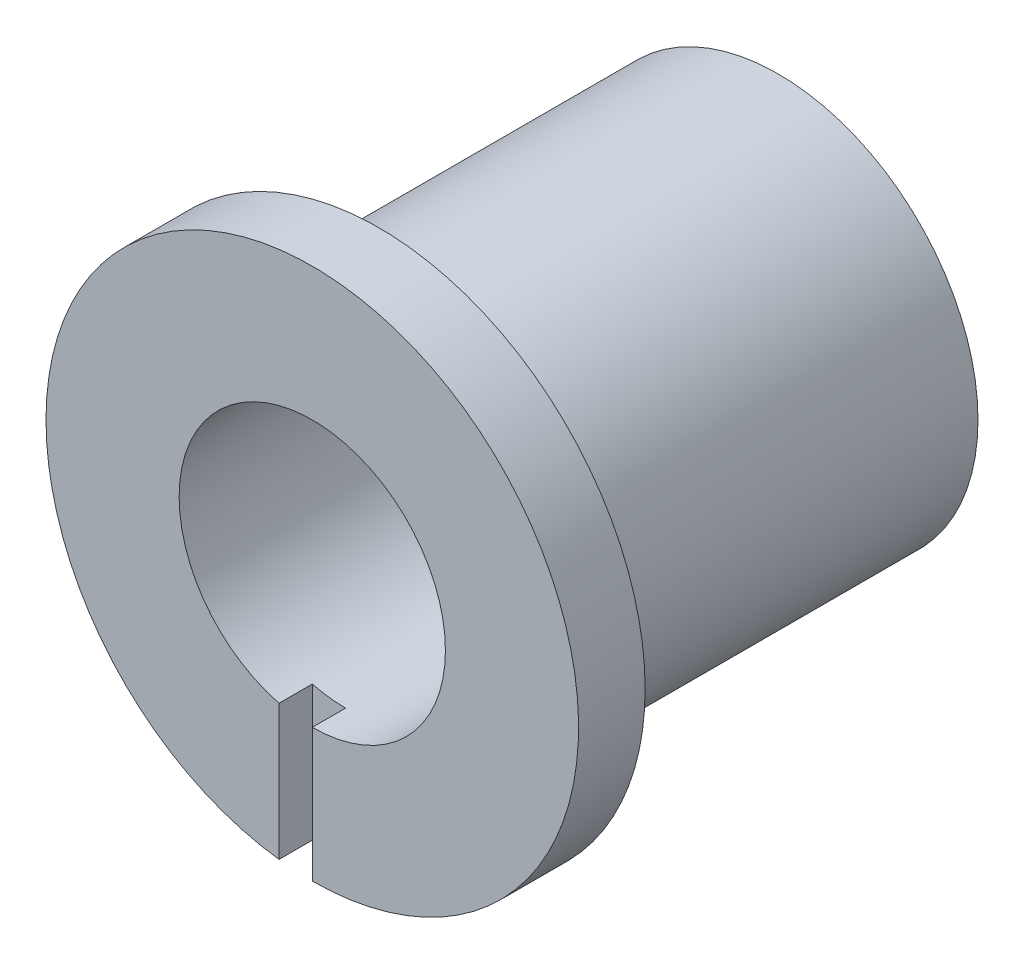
SolidWorks part; units mm, degrees
ref_plane "Ebene vorne" through (0, 0, 0) normal (0, 0, 1) x (1, 0, 0)
ref_plane "Ebene oben" through (0, 0, 0) normal (0, 1, 0) x (1, 0, 0)
ref_plane "Ebene rechts" through (0, 0, 0) normal (1, 0, 0) x (0, 0, -1)
sketch "Skizze1" plane through (0, 0, 0) normal (0, 0, 1) x (1, 0, 0)
  circle A0 centre (0, 0) radius 30
  dimension "D1" = 60
extrude "Linear austragen1" add sketch "Skizze1" along normal blind 60
sketch "Skizze2" plane through (0, 0, 60) normal (0, 0, 1) x (1, 0, 0)
  circle A0 centre (0, 0) radius 40
  dimension "D1" = 80
extrude "Linear austragen2" add sketch "Skizze2" along normal blind 10
sketch "Skizze3" plane through (0, 0, 70) normal (0, 0, 1) x (1, 0, 0)
  circle A0 centre (0, 0) radius 20
  dimension "D1" = 40
extrude "Schnitt-Linear austragen1" cut sketch "Skizze3" against normal through all
sketch "Skizze4" plane through (0, 0, 70) normal (0, 0, 1) x (1, 0, 0)
  line L1 (0, 0) -> (-5, 0)
  line L2 (0, 0) -> (0, -80)
  line L3 (0, -80) -> (-5, -80)
  line L4 (-5, 0) -> (-5, -80)
  dimension "D1" = 5
  dimension "D2" = 80
extrude "Schnitt-Linear austragen2" cut sketch "Skizze4" against normal blind 5
